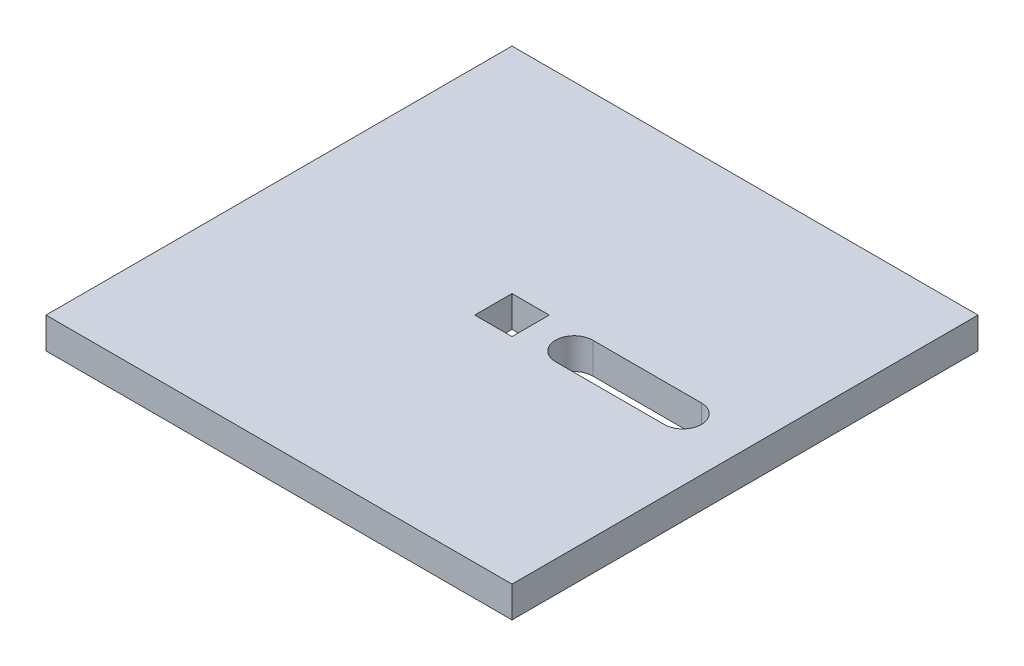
SolidWorks part; units mm, degrees
ref_plane "Front Plane" through (0, 0, 0) normal (0, 0, 1) x (1, 0, 0)
ref_plane "Top Plane" through (0, 0, 0) normal (0, 1, 0) x (1, 0, 0)
ref_plane "Right Plane" through (0, 0, 0) normal (1, 0, 0) x (0, 0, -1)
sketch "Sketch1" plane through (0, 0, 0) normal (0, 1, 0) x (1, 0, 0)
  line L1 (-75, 75) -> (75, 75)
  line L2 (-75, 75) -> (-75, -75)
  line L3 (-75, -75) -> (75, -75)
  line L4 (75, 75) -> (75, -75)
  line L5 (-75, 75) -> (75, -75) construction
  line L6 (-75, -75) -> (75, 75) construction
  point P0 (0, 0)
  dimension "D1" = 150
extrude "Boss-Extrude1" add sketch "Sketch1" along normal blind 10
sketch "Sketch3" plane through (0, 10, 0) normal (0, 1, 0) x (1, 0, 0)
  line L1 (-6, 6) -> (6, 6)
  line L2 (-6, 6) -> (-6, -6)
  line L3 (-6, -6) -> (6, -6)
  line L4 (6, 6) -> (6, -6)
  line L5 (-6, 6) -> (6, -6) construction
  line L6 (-6, -6) -> (6, 6) construction
  point P0 (0, 0)
  dimension "D1" = 12
extrude "Cut-Extrude2" cut sketch "Sketch3" against normal through all
sketch "Sketch2" plane through (0, 10, 0) normal (0, 1, 0) x (1, 0, 0)
  line L0 (0, 0) -> (20, 0) construction
  line L1 (20, 0) -> (55, 0) construction
  line L2 (20, 6) -> (55, 6)
  line L3 (20, -6) -> (55, -6)
  arc A0 (20, 6) -> (20, -6) centre (20, 0) ccw
  arc A1 (55, -6) -> (55, 6) centre (55, 0) ccw
  point P3 (37.5, 0)
  dimension "D2" = 6
  dimension "D1" = 35
  dimension "D3" = 20
extrude "Cut-Extrude1" cut sketch "Sketch2" against normal through all
